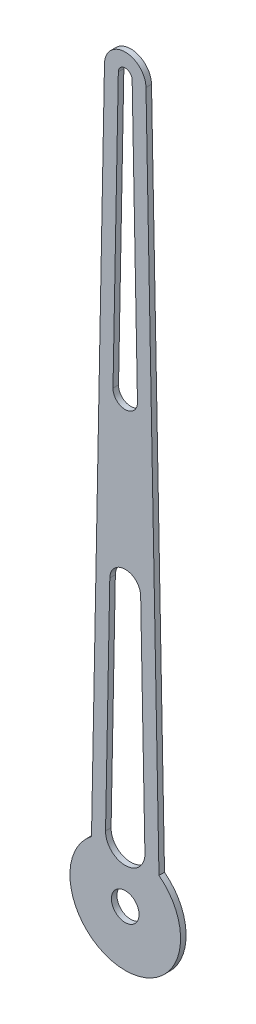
SolidWorks part; units mm, degrees
ref_plane "Front" through (0, 0, 0) normal (0, 0, 1) x (1, 0, 0)
ref_plane "Top" through (0, 0, 0) normal (0, 1, 0) x (1, 0, 0)
ref_plane "Right" through (0, 0, 0) normal (1, 0, 0) x (0, 0, -1)
sketch "Sketch1" plane through (0, 0, 0) normal (0, 0, 1) x (1, 0, 0)
  line L0 (-19.6851, 0) -> (20.2961, 0) construction
  line L1 (0, 17.3189) -> (0, -16.8635) construction
  circle A0 centre (10, 0) radius 1.75 construction
  circle A1 centre (-7.5, 0) radius 4 construction
  circle A2 centre (0, 7.5) radius 4 construction
  circle A3 centre (0, -7.5) radius 4 construction
  point P12 (0, 0)
  dimension "D1" = 8
  dimension "D2" = 8
  dimension "D3" = 8
  dimension "D4" = 3.5
  dimension "D5" = 10
  dimension "D6" = 7.5
  dimension "D7" = 7.5
  dimension "D8" = 7.5
sketch "Sketch2" plane through (0, 0, 0) normal (0, 0, 1) x (1, 0, 0)
  line L0 (0, 17.3189) -> (0, -16.8635) construction
  line L1 (0.3749, 13.0072) -> (0.6099, 0.7925)
  line L2 (-0.3749, 13.0072) -> (-0.6099, 0.7925)
  line L3 (0.125, 13.0024) -> (0.2211, 8.0043)
  line L4 (-0.125, 13.0024) -> (-0.2211, 8.0043)
  line L5 (-0.2788, 5.0054) -> (-0.3557, 1.0068)
  line L6 (0.2788, 5.0054) -> (0.3557, 1.0068)
  arc A0 (-0.3557, 1.0068) -> (0.3557, 1.0068) centre (0, 1) ccw
  arc A1 (0.3749, 13.0072) -> (-0.3749, 13.0072) centre (0, 13) ccw
  arc A2 (-0.6099, 0.7925) -> (0.6099, 0.7925) centre (0, 0) ccw
  circle A3 centre (0, 0) radius 0.25
  arc A4 (0.125, 13.0024) -> (-0.125, 13.0024) centre (0, 13) ccw
  arc A5 (0.2788, 5.0054) -> (-0.2788, 5.0054) centre (0, 5) ccw
  arc A6 (-0.2211, 8.0043) -> (0.2211, 8.0043) centre (0, 8) ccw
  dimension "D1" = 4
  dimension "D2" = 0.75
  dimension "D4" = 0.25
  dimension "D5" = 5
  dimension "D3" = 13
  dimension "D6" = 5
extrude "Base-Extrude" add sketch "Sketch2" along normal blind 0.1
